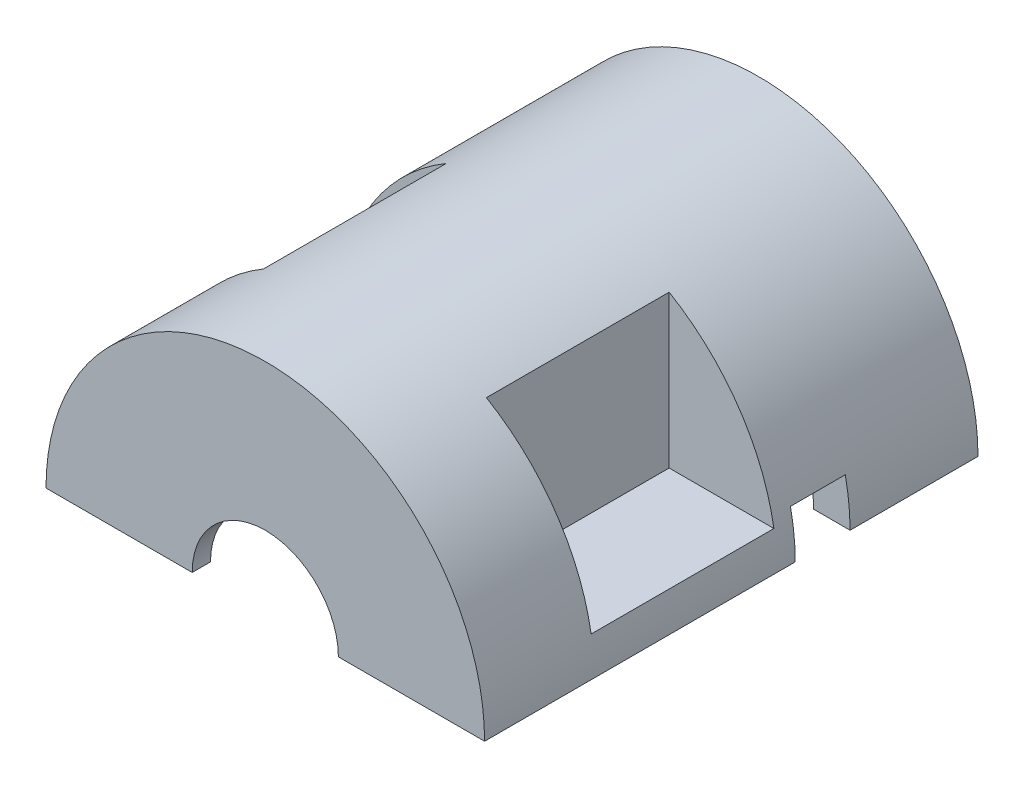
SolidWorks part; units mm, degrees
ref_plane "Front Plane" through (0, 0, 0) normal (0, 0, 1) x (1, 0, 0)
ref_plane "Top Plane" through (0, 0, 0) normal (0, 1, 0) x (1, 0, 0)
ref_plane "Right Plane" through (0, 0, 0) normal (1, 0, 0) x (0, 0, -1)
sketch "Sketch1" plane through (0, 0, 0) normal (0, 0, 1) x (1, 0, 0)
  circle A0 centre (0, 0) radius 15.24
  dimension "D1" = 30.48
extrude "Boss-Extrude1" add sketch "Sketch1" along normal blind 34.29
sketch "Sketch2" plane through (0, 0, 34.29) normal (0, 0, 1) x (1, 0, 0)
  line L1 (-15.24, 0) -> (17.4424, 0)
  line L2 (-15.24, 0) -> (-15.24, -21.4509)
  line L3 (-15.24, -21.4509) -> (17.4424, -21.4509)
  line L4 (17.4424, 0) -> (17.4424, -21.4509)
  circle A0 centre (0, 0) radius 15.24 construction
extrude "Cut-Extrude1" cut sketch "Sketch2" against normal through all
sketch "Sketch3" plane through (0, 0, 0) normal (0, -1, 0) x (1, 0, 0)
  line L0 (0, -2.0167) -> (0, 53.0196) construction
  line L1 (5.08, 34.29) -> (5.08, 33.02)
  line L2 (15.24, 34.29) -> (-15.24, 34.29) construction
  line L3 (5.08, 33.02) -> (7.9375, 33.02)
  line L4 (7.9375, 33.02) -> (7.9375, 27.94)
  line L5 (7.9375, 27.94) -> (5.207, 27.94)
  line L6 (5.207, 27.94) -> (5.207, 12.7)
  line L7 (5.207, 12.7) -> (12.7, 12.7)
  line L8 (12.7, 12.7) -> (12.7, 0)
  line L9 (15.24, 0) -> (-15.24, 0) construction
  line L10 (12.7, 0) -> (0, 0)
  line L13 (5.08, 34.29) -> (0, 34.29)
  line L14 (0, 0) -> (0, 34.29)
  point P7 (5.08, 33.655)
  dimension "D1" = 7.9375
  dimension "D2" = 5.08
  dimension "D3" = 5.207
  dimension "D4" = 1.27
  dimension "D5" = 5.08
  dimension "D6" = 15.24
  dimension "D7" = 12.7
revolve "Cut-Revolve1" cut sketch "Sketch3" angle 360 about L0
sketch "Sketch5" plane through (0, 0, 0) normal (0, -1, 0) x (-1, 0, 0)
  line L0 (5.08, -34.29) -> (15.24, -34.29) construction
  line L1 (18.6324, -26.67) -> (7.747, -26.67)
  line L2 (18.6324, -26.67) -> (18.6324, -13.97)
  line L3 (18.6324, -13.97) -> (7.747, -13.97)
  line L4 (7.747, -26.67) -> (7.747, -13.97)
  line L5 (12.7, -12.7) -> (5.207, -12.7) construction
  line L6 (5.207, -12.7) -> (5.207, -27.94) construction
  line L7 (0, -41.0612) -> (0, 2.7565) construction
  line L8 (-18.6324, -13.97) -> (-7.747, -13.97)
  line L9 (-7.747, -26.67) -> (-7.747, -13.97)
  line L10 (-18.6324, -26.67) -> (-7.747, -26.67)
  line L11 (-18.6324, -26.67) -> (-18.6324, -13.97)
  dimension "D1" = 7.62
  dimension "D2" = 1.27
  dimension "D3" = 2.54
extrude "Cut-Extrude2" cut sketch "Sketch5" against normal through all from offset 2.54
sketch "Sketch8" plane through (0, 0, 0) normal (1, 0, 0) x (0, 0, -1)
  line L1 (-12.7, 0) -> (-8.89, 0)
  line L2 (-12.7, 0) -> (-12.7, 3.175)
  line L3 (-12.7, 3.175) -> (-8.89, 3.175)
  line L4 (-8.89, 0) -> (-8.89, 3.175)
  dimension "D1" = 3.81
  dimension "D2" = 3.175
extrude "Cut-Extrude5" cut sketch "Sketch8" against normal through all both and the other way through all
